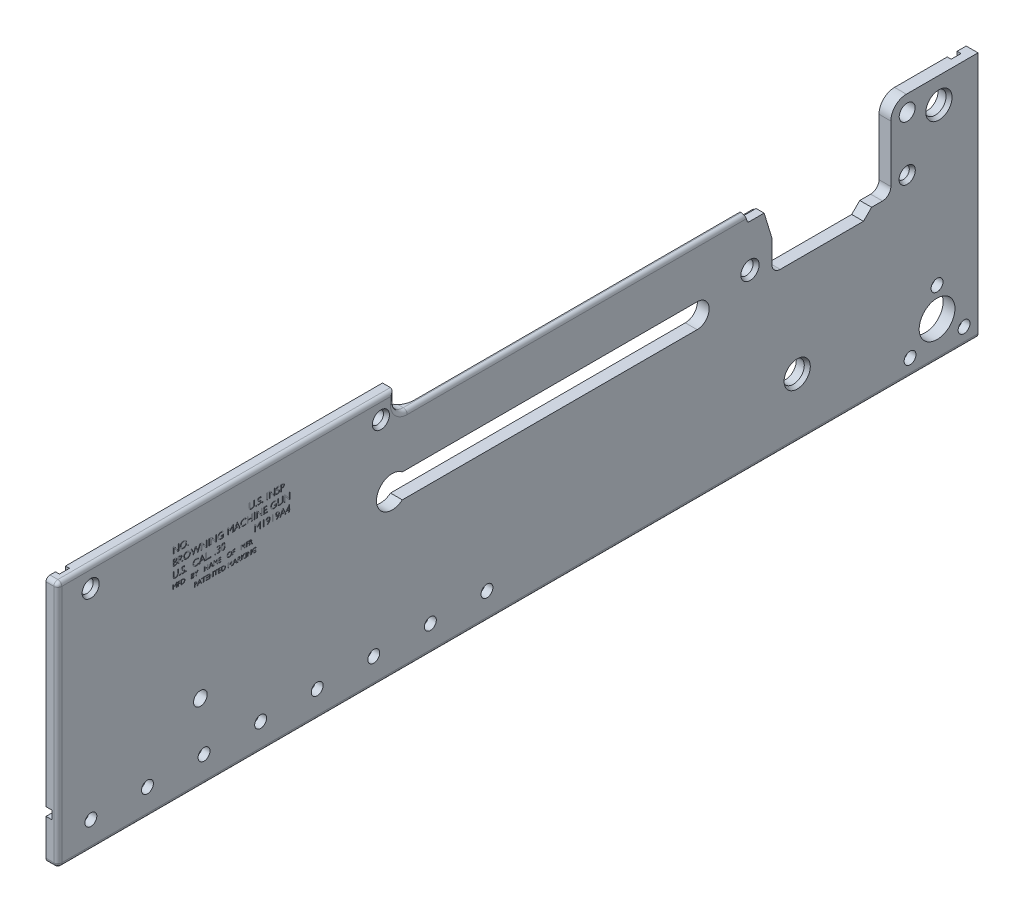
SolidWorks part; units mm, degrees
ref_plane "Спереди" through (0, 0, 0) normal (0, 0, 1) x (1, 0, 0)
ref_plane "Сверху" through (0, 0, 0) normal (0, 1, 0) x (1, 0, 0)
ref_plane "Справа" through (0, 0, 0) normal (1, 0, 0) x (0, 0, -1)
sketch "Эскиз1" plane through (0, 0, 0) normal (1, 0, 0) x (0, 0, -1)
  line L0 (-160.9598, 74.9808) -> (-160.9598, 70.5866)
  line L1 (72.2376, 74.9808) -> (43.6118, 74.9808)
  line L2 (72.2376, 74.9808) -> (72.2376, -23.7998)
  line L3 (72.2376, -23.7998) -> (-293.8145, -23.7998)
  line L4 (-295.402, 73.3933) -> (-295.402, -22.2123)
  line L5 (-155.8036, 65.4304) -> (-20.8185, 65.4304)
  line L6 (-20.8185, 65.4304) -> (-20.0401, 62.8845)
  line L7 (-19.19, 62.2554) -> (-13.2077, 62.2554)
  line L8 (-13.2077, 62.2554) -> (-10.1092, 52.1208)
  line L9 (-10.1092, 52.1208) -> (-10.1092, 42.9006)
  line L10 (-6.7818, 39.5732) -> (26.4922, 39.5732)
  line L11 (26.4922, 39.5732) -> (29.718, 42.799)
  line L12 (29.718, 42.799) -> (34.0868, 42.799)
  line L13 (37.4142, 46.1264) -> (37.4142, 68.7832)
  line L14 (-160.9598, 74.9808) -> (-293.8145, 74.9808)
  line L15 (-183.2237, 40.132) -> (-35.1536, 40.132) construction
  line L16 (-157.7694, 44.958) -> (-39.9796, 44.958)
  line L17 (-157.7694, 35.306) -> (-39.9796, 35.306)
  circle A0 centre (0, 0) radius 4.3523
  arc A1 (-160.9598, 70.5866) -> (-155.8036, 65.4304) centre (-155.8036, 70.5866) ccw
  arc A2 (34.0868, 42.799) -> (37.4142, 46.1264) centre (34.0868, 46.1264) ccw
  arc A3 (-10.1092, 42.9006) -> (-6.7818, 39.5732) centre (-6.7818, 42.9006) ccw
  arc A4 (-20.0401, 62.8845) -> (-19.19, 62.2554) centre (-19.19, 63.1444) ccw
  arc A5 (37.4142, 68.7832) -> (43.6118, 74.9808) centre (43.6118, 68.7832) cw
  arc A7 (-293.8145, -23.7998) -> (-295.402, -22.2123) centre (-293.8145, -22.2123) cw
  arc A8 (-293.8145, 74.9808) -> (-295.402, 73.3933) centre (-293.8145, 73.3933) ccw
  arc A9 (-39.9796, 35.306) -> (-39.9796, 44.958) centre (-39.9796, 40.132) ccw
  arc A10 (-157.7694, 44.958) -> (-157.7694, 35.306) centre (-161.798, 40.132) ccw
  circle A11 centre (55.88, -8.89) radius 7.1501
  circle A12 centre (45.085, -17.018) radius 2.3685
  circle A13 centre (66.675, -17.018) radius 2.3686
  circle A14 centre (55.88, 2.7686) radius 2.3685
  circle A15 centre (-18.8468, 45.3898) radius 2.7648
  circle A16 centre (43.942, 68.58) radius 3.175
  circle A17 centre (56.642, 64.77) radius 4.3523
  circle A18 centre (43.942, 46.8884) radius 2.3685
  circle A19 centre (-282.2702, 66.929) radius 2.54
  circle A20 centre (-166.3192, 67.31) radius 2.54
  circle A21 centre (-238.4298, 6.9596) radius 2.7305
  circle A22 centre (-282.194, -13.1064) radius 2.3749
  circle A23 centre (-259.588, -13.1064) radius 2.3749
  circle A24 centre (-236.982, -13.1064) radius 2.3749
  circle A25 centre (-214.376, -13.1064) radius 2.3749
  circle A26 centre (-191.77, -13.1064) radius 2.3749
  circle A27 centre (-169.164, -13.1064) radius 2.3749
  circle A28 centre (-146.558, -13.1064) radius 2.3749
  circle A29 centre (-123.952, -13.1064) radius 2.3749
  dimension "D17" = 5.1562
  dimension "D18" = 3.3274
  dimension "D19" = 0.889
  dimension "D20" = 6.1976
  dimension "D21" = 1.5875
  dimension "D23" = 6.2865
  dimension "D27" = 8.7046
  dimension "D28" = 4.7371
  dimension "D35" = 14.3002
  dimension "D36" = 8.7046
  dimension "D37" = 4.7371
  dimension "D38" = 6.35
  dimension "D46" = 5.08
  dimension "D47" = 5.461
  dimension "D48" = 4.7498
  dimension "D58" = 5.5296
  dimension "D1" = 367.6396
  dimension "D2" = 98.7806
  dimension "D3" = 23.7998
  dimension "D4" = 72.2376
  dimension "D5" = 45
  dimension "D6" = 17
  dimension "D7" = 37.4142
  dimension "D8" = 26.4922
  dimension "D9" = 42.799
  dimension "D10" = 39.5732
  dimension "D11" = 6.35
  dimension "D12" = 10.1092
  dimension "D13" = 52.1208
  dimension "D14" = 160.9598
  dimension "D15" = 3.175
  dimension "D16" = 89.2302
  dimension "D22" = 9.652
  dimension "D24" = 161.798
  dimension "D25" = 40.132
  dimension "D26" = 39.9796
  dimension "D29" = 55.88
  dimension "D30" = 45.085
  dimension "D31" = 66.675
  dimension "D32" = 2.7686
  dimension "D33" = 8.89
  dimension "D34" = 17.018
  dimension "D39" = 18.8468
  dimension "D40" = 43.942
  dimension "D41" = 56.642
  dimension "D42" = 68.58
  dimension "D43" = 64.77
  dimension "D44" = 46.8884
  dimension "D45" = 45.3898
  dimension "D49" = 10.6934
  dimension "D50" = 282.194
  dimension "D52" = 66.929
  dimension "D53" = 67.31
  dimension "D54" = 6.9596
  dimension "D55" = 115.951
  dimension "D56" = 166.3192
  dimension "D57" = 238.4298
  dimension "D51" = 8
extrude "Бобышка-Вытянуть1" add sketch "Эскиз1" along normal blind 4.7244
sketch "Эскиз2" plane through (0, 74.9808, 0) normal (0, 1, 0) x (1, 0, 0)
  line L0 (0, -160.9598) -> (0, -293.8145) construction
  line L1 (0, -287.6296) -> (1.5748, -287.6296)
  line L2 (0, -287.6296) -> (0, -291.6174)
  line L3 (0, -291.6174) -> (1.5748, -291.6174)
  line L4 (1.5748, -287.6296) -> (1.5748, -291.6174)
  line L5 (0, 72.2376) -> (0, 43.6118) construction
  line L6 (0, 68.6054) -> (1.5748, 68.6054)
  line L7 (0, 68.6054) -> (0, 64.6684)
  line L8 (0, 64.6684) -> (1.5748, 64.6684)
  line L9 (1.5748, 68.6054) -> (1.5748, 64.6684)
  dimension "D1" = 1.5748
  dimension "D2" = 3.937
  dimension "D3" = 68.6054
  dimension "D4" = 291.6174
  dimension "D5" = 3.9878
extrude "Вырез-Вытянуть1" cut sketch "Эскиз2" against normal through all
sketch "Эскиз3" plane through (0, 65.4304, 0) normal (0, 1, 0) x (1, 0, 0)
  line L0 (0, -155.257) -> (0, -10.1092)
  line L1 (0, -10.1092) -> (1.524, -10.1092)
  line L2 (1.524, -10.1092) -> (1.524, -151.13)
  line L3 (0, -20.8185) -> (0, -155.8036) construction
  line L4 (4.7244, -10.1092) -> (0, -10.1092) construction
  arc A0 (1.524, -151.13) -> (0, -155.257) centre (-4.826, -151.13) cw
  dimension "D1" = 6.35
  dimension "D2" = 151.13
  dimension "D3" = 1.524
extrude "Вырез-Вытянуть2" cut sketch "Эскиз3" against normal blind 4.318
chamfer "Фаска1" distance 1.1906 angle 45 2 edges at (1.1308, 65.4304, 153.3297) (1.524, 65.4304, 85.9742)
ref_plane "Плоскость1" through (0, 72.6186, 0) normal (0, -1, 0) x (-1, 0, 0)
ref_plane "Плоскость2" through (0, -4.3942, 0) normal (0, 1, 0) x (1, 0, 0)
sketch "Эскиз4" plane through (0, -4.3942, 0) normal (0, 1, 0) x (1, 0, 0)
  line L0 (0, -235.2603) -> (0, -295.402)
  line L1 (0, -295.402) -> (2.3876, -295.402)
  line L2 (2.3876, -295.402) -> (2.3876, -242.0938)
  line L3 (4.7244, -295.402) -> (0, -295.402) construction
  line L4 (0, -160.9598) -> (0, -287.6296) construction
  line L5 (4.7244, -160.9598) -> (4.7244, -293.8145) construction
  arc A0 (2.3876, -242.0938) -> (0, -235.2603) centre (-8.5852, -242.0938) ccw
  dimension "D1" = 10.9728
  dimension "D2" = 2.3368
  dimension "D3" = 242.0938
extrude "Вырез-Вытянуть3" cut sketch "Эскиз4" against normal blind 3.3528
sketch "Эскиз5" plane through (0, 72.6186, 0) normal (0, -1, 0) x (-1, 0, 0)
  line L0 (0, -294.3615) -> (0, -155.8036)
  line L1 (0, -155.8036) -> (-2.3876, -155.8036)
  line L2 (-2.3876, -155.8036) -> (-2.3876, -287.528)
  line L3 (0, -160.9598) -> (0, -287.6296) construction
  line L4 (-4.7244, -155.8036) -> (-1.0916, -155.8036) construction
  line L5 (-4.7244, -160.9598) -> (-4.7244, -293.8145) construction
  arc A0 (-2.3876, -287.528) -> (0, -294.3615) centre (8.5852, -287.528) ccw
  dimension "D1" = 10.9728
  dimension "D2" = 2.3368
  dimension "D3" = 287.528
extrude "Вырез-Вытянуть4" cut sketch "Эскиз5" along normal blind 2.5654
fillet "Скругление1" radius 1.5875 8 edges at (4.7244, 65.4304, 88.311) (4.7244, 72.7837, 160.9598) (4.7244, -23.7998, 110.7885) (4.7244, -23.3348, 294.937) (4.7244, 25.5905, 295.402) (4.7244, 74.5158, 294.937) (4.7244, 66.9406, 159.4496) (4.7244, 74.9808, 227.3872)
chamfer "Фаска2" distance 1.5748 angle 30 8 edges at (0, -13.1064, 121.5771) (0, -13.1064, 144.1831) (0, -13.1064, 166.7891) (0, -13.1064, 189.3951) (0, -13.1064, 212.0011) (0, -13.1064, 234.6071) (0, -13.1064, 257.2131) (0, -13.1064, 279.8191)
chamfer "Фаска3" distance 1.524 angle 30 8 edges at (4.7244, 0, -4.3523) (0, 2.7686, -58.2486) (0, -17.018, -47.4535) (4.7244, 64.77, -60.9943) (4.7244, 46.8884, -46.3105) (4.7244, 45.3898, 16.082) (4.7244, 67.31, 163.7792) (4.7244, 66.929, 279.7302)
sketch "Эскиз6" plane through (4.7244, 0, 0) normal (1, 0, 0) x (0, 0, -1)
  line L0 (-249.682, 28.4925) -> (-249.682, 87.0144) construction
  line L1 (-295.402, -22.2123) -> (-295.402, 73.3933) construction
  line L2 (-249.682, 62.2808) -> (-230.842, 62.2808) construction
  line L3 (-293.8145, 74.9808) -> (-160.9598, 74.9808) construction
  line L4 (-219.202, 62.2808) -> (-193.9505, 62.2808) construction
  line L5 (-249.682, 57.9628) -> (-193.9505, 57.9628) construction
  line L7 (-249.682, 53.6448) -> (-193.9505, 53.6448) construction
  line L9 (-249.682, 50.0888) -> (-198.7583, 50.0888) construction
  line L10 (-249.682, 46.5328) -> (-198.7583, 46.5328) construction
  text T0 "NO." font "Gill Sans MT" height 2.54
  text T1 "U.S. INSP" font "Gill Sans MT" height 2.54
  text T2 "BROWNING MACHINE GUN" font "Gill Sans MT" height 2.54
  text T3 "U.S.  CAL. .30           M1919A4" font "Gill Sans MT" height 2.54
  text T4 "MFD   BY   NAME   OF   MFR" font "Gill Sans MT" height 1.778
  text T5 "            PATENTED MARKING" font "Gill Sans MT" height 1.778
  dimension "D1" = 45.72
  dimension "D2" = 12.7
  dimension "D3" = 4.318
  dimension "D4" = 4.318
  dimension "D5" = 3.556
  dimension "D6" = 3.556
  dimension "D7" = 30.48
extrude "Вырез-Вытянуть5" cut sketch "Эскиз6" against normal blind 0.127
equation "\"D16@Эскиз1\"=3.792-0.279"
equation "\"D50@Эскиз1\"=11.481-0.371"
